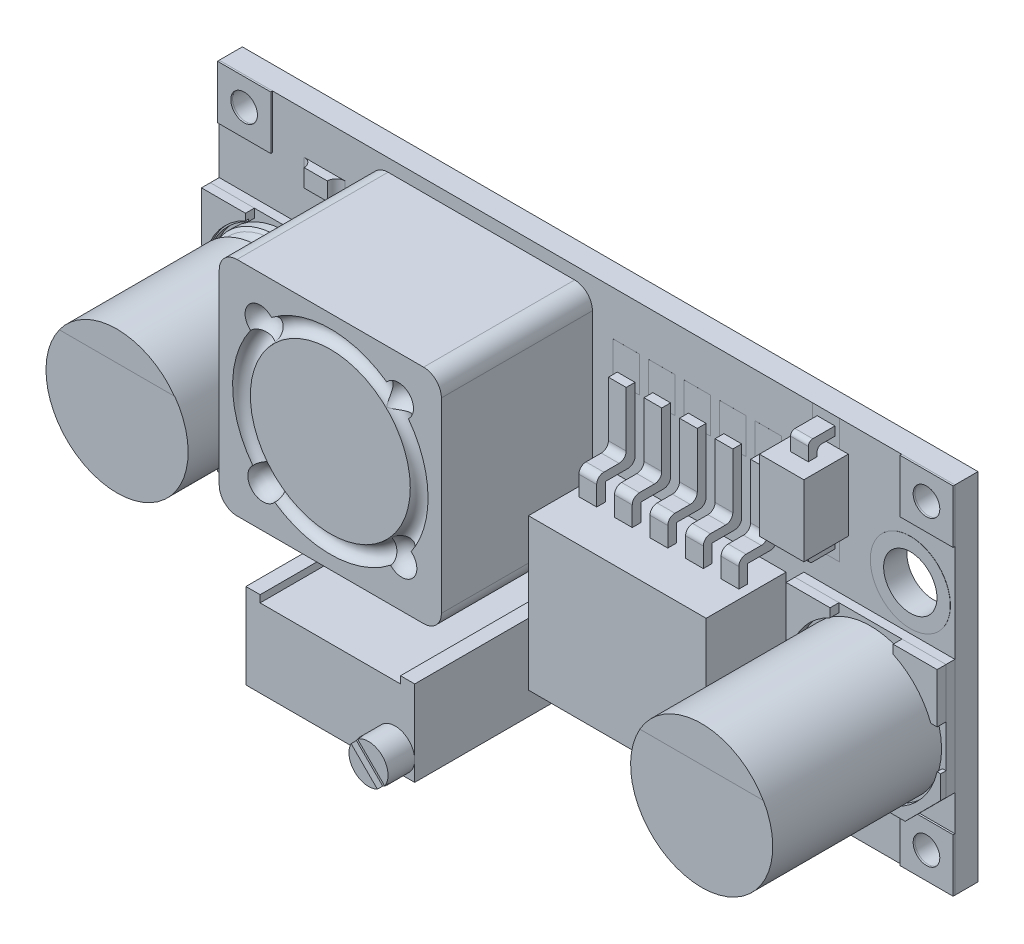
SolidWorks part; units mm, degrees
ref_plane "Ön Düzlem" through (0, 0, 0) normal (0, 0, 1) x (1, 0, 0)
ref_plane "Üst Düzlem" through (0, 0, 0) normal (0, 1, 0) x (1, 0, 0)
ref_plane "Sağ Düzlem" through (0, 0, 0) normal (1, 0, 0) x (0, 0, -1)
sketch "Çizim2" plane through (0, 0, 0) normal (0, 0, 1) x (1, 0, 0)
  line L1 (0, 0) -> (41.4, 0)
  line L2 (0, 0) -> (0, 20)
  line L3 (0, 20) -> (41.4, 20)
  line L4 (41.4, 0) -> (41.4, 20)
  dimension "D1" = 20
  dimension "D2" = 41.4
extrude "Yükseklik-Ekstrüzyon1" add sketch "Çizim2" along normal blind 1.3
sketch "Çizim3" plane through (0, 0, 1.3) normal (0, 0, 1) x (1, 0, 0)
  line L1 (0, 20) -> (3, 20)
  line L2 (0, 20) -> (0, 17)
  line L3 (0, 17) -> (3, 17)
  line L4 (3, 20) -> (3, 17)
  line L5 (0, 0) -> (3, 0)
  line L6 (0, 0) -> (0, 3)
  line L7 (0, 3) -> (3, 3)
  line L8 (3, 0) -> (3, 3)
  line L9 (41.4, 0) -> (38.4, 0)
  line L10 (41.4, 0) -> (41.4, 3)
  line L11 (41.4, 3) -> (38.4, 3)
  line L12 (38.4, 0) -> (38.4, 3)
  line L13 (41.4, 20) -> (38.4, 20)
  line L14 (41.4, 20) -> (41.4, 17)
  line L15 (41.4, 17) -> (38.4, 17)
  line L16 (38.4, 20) -> (38.4, 17)
  dimension "D1" = 3
  dimension "D2" = 3
  dimension "D3" = 3
  dimension "D4" = 3
  dimension "D5" = 3
  dimension "D6" = 3
  dimension "D7" = 3
  dimension "D8" = 3
extrude "Yükseklik-Ekstrüzyon3" add sketch "Çizim3" along normal blind 0.1 separate body
sketch "Çizim4" plane through (0, 0, 1.4) normal (0, 0, 1) x (1, 0, 0)
  line L0 (38.4, 3) -> (38.4, 0) construction
  line L1 (41.4, 3) -> (38.4, 3) construction
  line L2 (0, 10) -> (50.265, 10) construction
  line L3 (0, 20) -> (0, 0) construction
  line L4 (20.7, 20) -> (20.7, 0) construction
  line L5 (41.4, 20) -> (0, 20) construction
  line L6 (0, 0) -> (41.4, 0) construction
  circle A0 centre (39.9, 1.5) radius 0.75
  circle A1 centre (39.9, 18.5) radius 0.75
  circle A2 centre (1.5, 18.5) radius 0.75
  circle A3 centre (1.5, 1.5) radius 0.75
  dimension "D1" = 1.5
  dimension "D2" = 1.5
  dimension "D3" = 1.5
extrude "Kes-Ekstrüzyon1" cut sketch "Çizim4" against normal through all
sketch "Çizim5" plane through (0, 0, 1.3) normal (0, 0, 1) x (1, 0, 0)
  line L0 (11.5, 0.3) -> (21, 0.3)
  line L1 (21, 0.3) -> (21, 5.1)
  line L2 (21, 5.1) -> (20.2, 5.1)
  line L3 (20.2, 5.1) -> (20.2, 4.7)
  line L4 (20.2, 4.7) -> (12.3, 4.7)
  line L5 (12.3, 4.7) -> (12.3, 5.1)
  line L6 (12.3, 5.1) -> (11.5, 5.1)
  line L7 (11.5, 5.1) -> (11.5, 0.3)
  line L8 (0, 20) -> (0, 0) construction
  line L9 (0, 0) -> (41.4, 0) construction
  dimension "D1" = 11.5
  dimension "D2" = 9.5
  dimension "D3" = 0.8
  dimension "D4" = 0.8
  dimension "D5" = 0.3
  dimension "D6" = 4.8
  dimension "D7" = 4.4
  dimension "D8" = 4.8
extrude "Yükseklik-Ekstrüzyon4" add sketch "Çizim5" along normal blind 10
sketch "Çizim6" plane through (0, 0, 11.3) normal (0, 0, 1) x (1, 0, 0)
  line L0 (21, 0.3) -> (21, 5.1) construction
  line L1 (11.5, 0.3) -> (21, 0.3) construction
  circle A0 centre (19.9, 1.4) radius 1.1
  dimension "D1" = 2.2
extrude "Yükseklik-Ekstrüzyon5" add sketch "Çizim6" along normal blind 1.5
sketch "Çizim7" plane through (0, 0, 12.8) normal (0, 0, 1) x (1, 0, 0)
  line L0 (18.7701, 2.0519) -> (19.1564, 2.4382)
  line L1 (19.1564, 2.4382) -> (21, 0.5946)
  line L2 (21, 0.3) -> (21, 1.4) construction
  line L3 (21, 0.5946) -> (20.6137, 0.2083)
  line L4 (20.6137, 0.2083) -> (18.7701, 2.0519)
  line L5 (18.7701, 2.0519) -> (18.7867, 2.0602)
extrude "Kes-Ekstrüzyon2" cut sketch "Çizim7" against normal blind 0.3 contours L4 L1 M5
sketch "Çizim8" plane through (0, 0, 1.3) normal (0, 0, 1) x (1, 0, 0)
  line L0 (0, 20) -> (0, 0) construction
  line L1 (0, 0) -> (41.4, 0) construction
  circle A0 centre (6, 2.5) radius 1.5
  dimension "D1" = 3
  dimension "D2" = 6
  dimension "D3" = 2.5
extrude "Kes-Ekstrüzyon3" cut sketch "Çizim8" against normal blind 10
sketch "Çizim9" plane through (0, 0, 1.3) normal (0, 0, 1) x (1, 0, 0)
  circle A0 centre (6, 2.5) radius 2.25
  circle A1 centre (6, 2.5) radius 1.5
  dimension "D1" = 4.5
extrude "Yükseklik-Ekstrüzyon7" add sketch "Çizim9" along normal blind 0.05
sketch "Çizim10" plane through (0, 0, 1.3) normal (0, 0, 1) x (1, 0, 0)
  line L1 (9.3325, 4.1337) -> (10.3325, 4.1337)
  line L2 (9.3325, 4.1337) -> (9.3325, 1.1337)
  line L3 (9.3325, 1.1337) -> (10.3325, 1.1337)
  line L4 (10.3325, 4.1337) -> (10.3325, 1.1337)
  dimension "D1" = 3
  dimension "D2" = 1
extrude "Yükseklik-Ekstrüzyon8" add sketch "Çizim10" along normal blind 0.5
sketch "Çizim11" plane through (9.3325, 0, 0) normal (-1, 0, 0) x (0, 0, 1)
  line L0 (1.3, 3.6337) -> (1.3, 4.1337)
  line L1 (1.3, 4.1337) -> (1.3, 1.1337) construction
  line L2 (1.8, 4.1337) -> (1.8, 1.1337) construction
  line L3 (1.3, 3.6337) -> (1.8, 3.6337)
  line L4 (1.8, 3.6337) -> (1.8, 4.1337)
  line L5 (1.8, 4.1337) -> (1.3, 4.1337)
  line L6 (1.3, 4.1337) -> (1.8, 4.1337)
  line L7 (1.8, 2.6337) -> (1.3, 2.6337) construction
  line L8 (1.3, 1.1337) -> (1.8, 1.1337)
  line L9 (1.8, 1.1337) -> (1.3, 1.1337)
  line L10 (1.8, 1.6337) -> (1.8, 1.1337)
  line L11 (1.3, 1.6337) -> (1.8, 1.6337)
  line L12 (1.3, 1.6337) -> (1.3, 1.1337)
  arc A0 (1.8, 3.6337) -> (1.3, 4.1337) centre (1.8, 4.1337) cw
  arc A1 (1.8, 1.6337) -> (1.3, 1.1337) centre (1.8, 1.1337) ccw
  point P0 (1.3, 3.6337)
  point P1 (1.8, 3.6337)
  point P4 (1.3, 4.1337)
  dimension "D1" = 0.5
extrude "Kes-Ekstrüzyon5" cut sketch "Çizim11" against normal blind 1 contours A0 M3 M4 | A1 M3 M2
sketch "Çizim12" plane through (0, 0, 1.3) normal (0, 0, 1) x (1, 0, 0)
  line L0 (21, 1.4) -> (21, 5.1) construction
  line L1 (8.5, 19.2887) -> (21, 19.2887)
  line L2 (8.5, 19.2887) -> (8.5, 6.7887)
  line L3 (8.5, 6.7887) -> (21, 6.7887)
  line L4 (21, 19.2887) -> (21, 6.7887)
  dimension "D1" = 12.5
  dimension "D2" = 12.5
extrude "Yükseklik-Ekstrüzyon9" add sketch "Çizim12" along normal blind 8.5
fillet "Radyus1" radius 1 4 edges at (8.5, 6.7887, 5.55) (21, 6.7887, 5.55) (21, 19.2887, 5.55) (8.5, 19.2887, 5.55)
ref_plane "Düzlem1" through (0, 13.0387, 0) normal (0, 1, 0) x (1, 0, 0)
sketch "Çizim14" plane through (0, 13.0387, 0) normal (0, 1, 0) x (1, 0, 0)
  line L0 (14.751, -9.8) -> (14.751, -0.4619) construction
  line L1 (10.251, -9.8) -> (9.251, -9.8)
  line L2 (20, -9.8) -> (9.5, -9.8) construction
  arc A0 (10.251, -9.8) -> (9.251, -9.8) centre (9.751, -9.8) ccw
  dimension "D1" = 1
  dimension "D2" = 5
revolve "Kes-Döndür1" cut sketch "Çizim14" angle 360 about L0
sketch "Çizim15" plane through (0, 0, 9.8) normal (0, 0, 1) x (1, 0, 0)
  line L0 (17.9163, 17.5156) -> (19.1436, 16.3486) construction
  line L1 (17.9163, 17.5156) -> (19.1436, 16.3486)
  arc A0 (19.1436, 16.3486) -> (17.9163, 17.5156) centre (18.5811, 16.9859) ccw
  circle A1 centre (14.751, 13.0387) radius 5.5 construction
  dimension "D2" = 1.7
revolve "Kes-Döndür2" cut sketch "Çizim15" angle 360 about L0
sketch "Çizim16" plane through (0, 0, 9.8) normal (0, 0, 1) x (1, 0, 0)
  line L0 (18.1439, 8.71) -> (19.3009, 9.9486)
  arc A0 (18.1439, 8.71) -> (19.3009, 9.9486) centre (18.7704, 9.2845) ccw
  arc A1 (17.9272, 17.5289) -> (19.1436, 16.3486) centre (14.751, 13.0387) ccw construction
  dimension "D1" = 1.7
revolve "Kes-Döndür3" cut sketch "Çizim16" angle 360 about L0
sketch "Çizim17" plane through (0, 0, 9.8) normal (0, 0, 1) x (1, 0, 0)
  line L0 (10.2607, 16.2147) -> (11.4409, 17.4312)
  arc A0 (11.4409, 17.4312) -> (10.2607, 16.2147) centre (10.8037, 16.8687) ccw
  arc A1 (17.9272, 17.5289) -> (18.1439, 8.71) centre (14.751, 13.0387) ccw construction
  dimension "D1" = 1.7
revolve "Kes-Döndür4" cut sketch "Çizim17" angle 360 about L0
sketch "Çizim18" plane through (0, 0, 9.8) normal (0, 0, 1) x (1, 0, 0)
  line L0 (11.6178, 8.5185) -> (10.3902, 9.6871)
  arc A0 (10.3902, 9.6871) -> (11.6178, 8.5185) centre (10.9587, 9.0552) ccw
  arc A1 (10.2607, 16.2147) -> (18.1439, 8.71) centre (14.751, 13.0387) ccw construction
  dimension "D1" = 1.7
revolve "Kes-Döndür5" cut sketch "Çizim18" angle 360 about L0
sketch "Çizim19" plane through (0, 0, 1.3) normal (0, 0, 1) x (1, 0, 0)
  line L0 (0, 20) -> (0, 0) construction
  line L1 (0, 14.2784) -> (8.5, 14.2784)
  line L2 (0, 14.2784) -> (0, 7.7784)
  line L3 (2, 5.7784) -> (6.5, 5.7784)
  line L4 (8.5, 14.2784) -> (8.5, 7.7784)
  line L5 (0, 7.7784) -> (2, 5.7784)
  line L6 (8.5, 7.7784) -> (6.5, 5.7784)
  point P1 (8.5, 5.7784)
  point P2 (0, 5.7784)
  point P8 (0, 10)
  point P9 (0, 10.0284)
  dimension "D1" = 8.5
  dimension "D2" = 8.5
  dimension "D3" = 2
  dimension "D4" = 45
  dimension "D5" = 2
  dimension "D6" = 45
extrude "Yükseklik-Ekstrüzyon13" add sketch "Çizim19" along normal blind 0.5 separate body
sketch "Çizim20" plane through (0, 0, 1.8) normal (0, 0, 1) x (1, 0, 0)
  line L0 (8.5, 14.2784) -> (0, 14.2784) construction
  line L1 (0, 14.2784) -> (0, 7.7784) construction
  line L2 (8.2976, 9.0941) -> (8.5, 9.0941)
  line L3 (8.5, 7.7784) -> (8.5, 14.2784) construction
  line L4 (8.5, 9.0941) -> (8.5, 7.7887)
  line L5 (8.5, 7.7887) -> (6.5, 5.7784)
  line L6 (6.5, 5.7784) -> (5.0293, 5.7784)
  line L7 (2, 5.7784) -> (6.5, 5.7784) construction
  line L8 (5.0293, 5.7784) -> (5.0293, 5.9481)
  line L9 (3.4559, 5.7784) -> (3.4559, 5.951)
  line L10 (3.4559, 5.7784) -> (2, 5.7784)
  line L11 (2, 5.7784) -> (0, 7.7784)
  line L12 (0, 7.7784) -> (0, 9.554)
  line L13 (0, 9.554) -> (0.1231, 9.554)
  line L14 (0.3573, 11.4787) -> (0, 11.4787)
  line L15 (0, 11.4787) -> (0, 14.2784)
  line L16 (0, 14.2784) -> (2.4756, 14.2784)
  line L17 (2.4756, 14.2784) -> (2.4756, 13.7844)
  line L18 (4.25, 14.2784) -> (4.25, 14.0284) construction
  line L19 (6.0244, 14.2784) -> (6.0244, 13.7844)
  line L20 (8.5, 14.2784) -> (6.0244, 14.2784)
  line L21 (8.5, 11.4787) -> (8.5, 14.2784)
  line L22 (8.1427, 11.4787) -> (8.5, 11.4787)
  circle A0 centre (4.25, 10.0284) radius 4
  arc A1 (5.0293, 5.9481) -> (8.2976, 9.0941) centre (4.25, 10.0284) ccw
  arc A2 (0.1231, 9.554) -> (3.4559, 5.951) centre (4.25, 10.0284) ccw
  arc A3 (2.4756, 13.7844) -> (0.3573, 11.4787) centre (4.25, 10.0284) ccw
  arc A4 (8.1427, 11.4787) -> (6.0244, 13.7844) centre (4.25, 10.0284) ccw
  dimension "D1" = 8
  dimension "D2" = 4.25
  dimension "D3" = 4.25
extrude "Yükseklik-Ekstrüzyon14" add sketch "Çizim20" along normal blind 0.3 separate body
sketch "Çizim21" plane through (0, 0, 2.1) normal (0, 0, 1) x (1, 0, 0)
  line L0 (0, 11.4787) -> (0, 14.2784)
  line L1 (0, 14.2784) -> (2.4756, 14.2784)
  line L2 (2.4756, 14.2784) -> (2.4756, 13.7844)
  line L3 (0, 11.4787) -> (0.3573, 11.4787)
  line L4 (4.25, 14.3771) -> (4.25, 9.7763) construction
  line L5 (8.5, 11.4787) -> (8.1427, 11.4787)
  line L6 (6.0244, 14.2784) -> (6.0244, 13.7844)
  line L7 (8.5, 14.2784) -> (6.0244, 14.2784)
  line L8 (8.5, 11.4787) -> (8.5, 14.2784)
  arc A0 (2.4756, 13.7844) -> (1.1909, 12.8388) centre (4.25, 10.0284) ccw
  arc A1 (2.4756, 13.7844) -> (0.3573, 11.4787) centre (4.25, 10.0284) ccw construction
  arc A2 (0.3573, 11.4787) -> (1.1909, 12.8388) centre (4.25, 10.0284) cw
  arc A3 (8.1427, 11.4787) -> (7.3091, 12.8388) centre (4.25, 10.0284) ccw
  arc A4 (6.0244, 13.7844) -> (7.3091, 12.8388) centre (4.25, 10.0284) cw
extrude "Yükseklik-Ekstrüzyon15" add sketch "Çizim21" along normal blind 0.2
sketch "Çizim22" plane through (0, 0, 2.1) normal (0, 0, 1) x (1, 0, 0)
  circle A0 centre (4.25, 10.0284) radius 4
extrude "Yükseklik-Ekstrüzyon16" add sketch "Çizim22" along normal blind 0.5
sketch "Çizim23" plane through (0, 0, 2.6) normal (0, 0, 1) x (1, 0, 0)
  circle A0 centre (4.25, 10.0284) radius 4
extrude "Yükseklik-Ekstrüzyon17" add sketch "Çizim23" along normal blind 8.7
ref_plane "Düzlem2" through (0, 10.1684, 0) normal (0, -1, 0) x (-1, 0, 0)
sketch "Çizim24" plane through (0, 10.1684, 0) normal (0, -1, 0) x (-1, 0, 0)
  line L0 (-4.25, -13.046) -> (-4.25, -1.3099) construction
  line L1 (-8.25, -11.3) -> (-0.25, -11.3) construction
  line L2 (-2, -1.8) -> (-6.5, -1.8) construction
  line L3 (-0.25, -11.3) -> (-0.25, -1.8) construction
  line L4 (-0.25, -2.3) -> (-0.25, -2.1319)
  line L5 (-0.25, -2.1319) -> (-0.5413, -2.3936)
  line L6 (-0.2499, -3.3645) -> (-0.25, -2.1319)
  line L7 (-0.25, -2.1319) -> (-0.108, -2.1319)
  line L8 (-0.108, -2.1319) -> (-0.108, -3.3645)
  line L9 (-0.108, -3.3645) -> (-0.2499, -3.3645)
  arc A0 (-0.25, -2.3) -> (-0.3102, -3.2964) centre (-0.25, -2.8) ccw
  arc A1 (-0.2499, -3.3645) -> (-0.3102, -3.2964) centre (-0.3185, -3.3645) ccw
  point P7 (-0.2499, -3.3645)
  point P8 (-4.25, -1.8)
  dimension "D3" = 1
  dimension "D1" = 0
  dimension "D2" = 11.7362
  dimension "D4" = 0
  dimension "D5" = 1
revolve "Kes-Döndür10" cut sketch "Çizim24" angle 360 about L0
sketch "Çizim25" plane through (0, 0, 11.3) normal (0, 0, 1) x (1, 0, 0)
  line L0 (1.0082, 12.3716) -> (7.4918, 12.3716)
  circle A0 centre (4.25, 10.0284) radius 4 construction
  arc A1 (7.4918, 12.3716) -> (1.0082, 12.3716) centre (4.25, 10.0284) ccw
extrude "Yükseklik-Ekstrüzyon18" add sketch "Çizim25" along normal blind 0.01
sketch "Çizim26" plane through (0, 0, 1.3) normal (0, 0, 1) x (1, 0, 0)
  line L1 (4.779, 17.6556) -> (7.079, 17.6556)
  line L2 (4.779, 17.6556) -> (4.779, 16.6556)
  line L3 (4.779, 16.6556) -> (7.079, 16.6556)
  line L4 (7.079, 17.6556) -> (7.079, 16.6556)
  dimension "D1" = 2.3
  dimension "D2" = 1
extrude "Yükseklik-Ekstrüzyon20" add sketch "Çizim26" along normal blind 0.5 separate body
sketch "Çizim29" plane through (0, 17.6556, 0) normal (0, 1, 0) x (1, 0, 0)
  line L1 (7.079, -1.8) -> (6.579, -1.8)
  line L2 (7.079, -1.8) -> (7.079, -1.3)
  line L6 (4.779, -1.8) -> (5.279, -1.8)
  line L7 (4.779, -1.8) -> (4.779, -1.3)
  arc A0 (6.579, -1.8) -> (7.079, -1.3) centre (7.079, -1.8) cw
  arc A1 (5.279, -1.8) -> (4.779, -1.3) centre (4.779, -1.8) ccw
extrude "Kes-Ekstrüzyon13" cut sketch "Çizim29" against normal blind 1
sketch "Çizim30" plane through (0, 0, 1.3) normal (0, 0, 1) x (1, 0, 0)
  line L0 (32.9, 11.5) -> (41.4, 11.5)
  line L1 (32.9, 11.5) -> (32.9, 5)
  line L2 (34.9, 3) -> (39.4, 3)
  line L3 (41.4, 11.5) -> (41.4, 5)
  line L4 (32.9, 5) -> (34.9, 3)
  line L5 (41.4, 5) -> (39.4, 3)
  line L8 (41.4, 0) -> (41.4, 20) construction
  line L9 (41.4, 3) -> (38.4, 3) construction
  point P1 (41.4, 3)
  point P2 (32.9, 3)
  point P6 (31.6305, 8.2841)
  point P7 (31.6305, 8.3125)
  dimension "D1" = 8.5
  dimension "D2" = 2
  dimension "D3" = 45
  dimension "D4" = 2
  dimension "D5" = 45
  dimension "D6" = 8.5
extrude "Yükseklik-Ekstrüzyon21" add sketch "Çizim30" along normal blind 0.5 separate body
sketch "Çizim32" plane through (0, 0, 1.8) normal (0, 0, 1) x (1, 0, 0)
  line L0 (41.1976, 6.3196) -> (41.4, 6.3196)
  line L1 (41.4, 6.3196) -> (41.4, 5.0142)
  line L2 (41.4, 5.0142) -> (39.4, 3.0039)
  line L3 (39.4, 3.0039) -> (37.9293, 3.0039)
  line L4 (37.9293, 3.0039) -> (37.9293, 3.1736)
  line L5 (36.3559, 3) -> (36.3559, 3.1765)
  line L6 (36.3559, 3) -> (34.9, 3)
  line L7 (34.9, 3) -> (32.9, 5)
  line L8 (32.9, 5) -> (32.9, 6.7795)
  line L9 (32.9, 6.7795) -> (33.0231, 6.7795)
  line L10 (33.2573, 8.7042) -> (32.9, 8.7042)
  line L11 (32.9, 8.7042) -> (32.9, 11.5)
  line L12 (32.9, 11.5) -> (35.3756, 11.5)
  line L13 (35.3756, 11.5) -> (35.3756, 11.0099)
  line L14 (37.15, 11.5039) -> (37.15, 11.2539) construction
  line L15 (38.9244, 11.5) -> (38.9244, 11.0099)
  line L16 (41.4, 11.5) -> (38.9244, 11.5)
  line L17 (41.4, 8.7042) -> (41.4, 11.5)
  line L18 (41.0427, 8.7042) -> (41.4, 8.7042)
  line L19 (34.9, 3) -> (39.4, 3) construction
  line L20 (32.9, 5) -> (34.9, 3) construction
  line L21 (32.9, 11.5) -> (32.9, 5) construction
  line L22 (41.4, 11.5) -> (32.9, 11.5) construction
  line L23 (41.4, 5) -> (41.4, 11.5) construction
  circle A0 centre (37.15, 7.2539) radius 4
  arc A1 (37.9293, 3.1736) -> (41.1976, 6.3196) centre (37.15, 7.2539) ccw
  arc A2 (33.0231, 6.7795) -> (36.3559, 3.1765) centre (37.15, 7.2539) ccw
  arc A3 (35.3756, 11.0099) -> (33.2573, 8.7042) centre (37.15, 7.2539) ccw
  arc A4 (41.0427, 8.7042) -> (38.9244, 11.0099) centre (37.15, 7.2539) ccw
  dimension "D1" = 8
extrude "Yükseklik-Ekstrüzyon22" add sketch "Çizim32" along normal blind 0.3 separate body
sketch "Çizim33" plane through (0, 0, 2.1) normal (0, 0, 1) x (1, 0, 0)
  line L0 (32.9, 11.5) -> (35.3756, 11.5)
  line L2 (35.3756, 11.5) -> (35.3756, 11.0099)
  line L3 (33.2573, 8.7042) -> (32.9, 8.7042)
  line L4 (32.9, 8.7042) -> (32.9, 11.5)
  line L6 (38.9244, 11.5) -> (41.4, 11.5)
  line L7 (41.4, 11.5) -> (41.4, 8.7042)
  line L8 (41.4, 8.7042) -> (41.0427, 8.7042)
  line L9 (38.9244, 11.0099) -> (38.9244, 11.5)
  arc A0 (33.2573, 8.7042) -> (35.3756, 11.0099) centre (37.15, 7.2539) cw
  arc A1 (41.0427, 8.7042) -> (38.9244, 11.0099) centre (37.15, 7.2539) ccw
extrude "Yükseklik-Ekstrüzyon24" add sketch "Çizim33" along normal blind 0.2
sketch "Çizim34" plane through (0, 0, 2.1) normal (0, 0, 1) x (1, 0, 0)
  circle A0 centre (37.15, 7.2539) radius 4
extrude "Yükseklik-Ekstrüzyon25" add sketch "Çizim34" along normal blind 0.5
sketch "Çizim35" plane through (0, 0, 2.6) normal (0, 0, 1) x (1, 0, 0)
  circle A0 centre (37.15, 7.2539) radius 4
extrude "Yükseklik-Ekstrüzyon26" add sketch "Çizim35" along normal blind 8.7
sketch "Çizim41" plane through (0, 0, 11.3) normal (0, 0, 1) x (1, 0, 0)
  line L0 (33.6784, 9.2409) -> (40.6216, 9.2409)
  circle A0 centre (37.15, 7.2539) radius 4 construction
  arc A1 (33.6784, 9.2409) -> (40.6216, 9.2409) centre (37.15, 7.2539) cw
extrude "Yükseklik-Ekstrüzyon27" add sketch "Çizim41" along normal blind 0.01
sketch "Çizim44" plane through (0, 0, 1.3) normal (0, 0, 1) x (1, 0, 0)
  line L0 (41.4, 0) -> (41.4, 20) construction
  line L1 (41.4, 20) -> (0, 20) construction
  circle A0 centre (38.9, 14) radius 1.5
  point P6 (38.7771, 15.0052)
  dimension "D1" = 3
  dimension "D2" = 2.5
  dimension "D3" = 6
extrude "Kes-Ekstrüzyon14" cut sketch "Çizim44" against normal through all
sketch "Çizim45" plane through (0, 0, 1.3) normal (0, 0, 1) x (1, 0, 0)
  circle A0 centre (38.9, 14) radius 2.25
  circle A1 centre (38.9, 14) radius 1.5
  dimension "D1" = 4.5
extrude "Yükseklik-Ekstrüzyon28" add sketch "Çizim45" along normal blind 0.01
sketch "Çizim46" plane through (0, 0, 1.3) normal (0, 0, 1) x (1, 0, 0)
  line L0 (41.4, 20) -> (0, 20) construction
  line L1 (32.9, 18.5) -> (35.4, 18.5)
  line L2 (32.9, 18.5) -> (32.9, 14.5)
  line L3 (32.9, 14.5) -> (35.4, 14.5)
  line L4 (35.4, 18.5) -> (35.4, 14.5)
  line L5 (32.9, 11.5) -> (32.9, 8.7042) construction
  dimension "D1" = 2.5
  dimension "D2" = 4
  dimension "D3" = 1.5
extrude "Yükseklik-Ekstrüzyon29" add sketch "Çizim46" along normal blind 2.5 separate body
sketch "Çizim48" plane through (0, 14.5, 0) normal (0, -1, 0) x (1, 0, 0)
  line L0 (32.9, 3.8) -> (35.4, 3.8) construction
  line L1 (33.65, 2.8) -> (34.65, 2.8)
  line L2 (33.65, 2.8) -> (33.65, 2.3)
  line L3 (33.65, 2.3) -> (34.65, 2.3)
  line L4 (34.65, 2.8) -> (34.65, 2.3)
  line L5 (35.4, 3.8) -> (35.4, 1.3) construction
  dimension "D1" = 1
  dimension "D2" = 0.5
  dimension "D3" = 1
  dimension "D4" = 0.75
extrude "Yükseklik-Ekstrüzyon30" add sketch "Çizim48" along normal blind 0.5 separate body
sketch "Çizim49" plane through (0, 18.5, 0) normal (0, 1, 0) x (1, 0, 0)
  line L0 (35.4, -3.8) -> (32.9, -3.8) construction
  line L1 (34.65, -2.8) -> (33.65, -2.8)
  line L2 (34.65, -2.8) -> (34.65, -2.3)
  line L3 (34.65, -2.3) -> (33.65, -2.3)
  line L4 (33.65, -2.8) -> (33.65, -2.3)
  line L5 (32.9, -3.8) -> (32.9, -1.3) construction
  dimension "D1" = 1
  dimension "D2" = 0.5
  dimension "D3" = 1
  dimension "D4" = 0.75
extrude "Yükseklik-Ekstrüzyon31" add sketch "Çizim49" along normal blind 0.5 separate body
sketch "Çizim50" plane through (0, 0, 2.8) normal (0, 0, 1) x (1, 0, 0)
  line L1 (33.65, 19) -> (34.65, 19)
  line L2 (33.65, 19) -> (33.65, 19.5)
  line L3 (33.65, 19.5) -> (34.65, 19.5)
  line L4 (34.65, 19) -> (34.65, 19.5)
  line L5 (34.65, 14) -> (33.65, 14)
  line L6 (34.65, 14) -> (34.65, 13.5)
  line L7 (34.65, 13.5) -> (33.65, 13.5)
  line L8 (33.65, 14) -> (33.65, 13.5)
  dimension "D1" = 0.5
  dimension "D2" = 0.5
  dimension "D3" = 1
  dimension "D4" = 1
extrude "Yükseklik-Ekstrüzyon32" add sketch "Çizim50" against normal blind 1.5
fillet "Radyus2" radius 0.25 4 edges at (34.15, 14, 2.3) (34.15, 13.5, 2.8) (34.15, 19, 2.3) (34.15, 19.5, 2.8)
sketch "Çizim51" plane through (0, 0, 1.3) normal (0, 0, 1) x (1, 0, 0)
  line L0 (0, 0) -> (41.4, 0) construction
  line L1 (21.9, 11) -> (31.9, 11)
  line L2 (21.9, 11) -> (21.9, 2.5)
  line L3 (21.9, 2.5) -> (31.9, 2.5)
  line L4 (31.9, 11) -> (31.9, 2.5)
  line L5 (32.9, 11.5) -> (32.9, 8.7042) construction
  dimension "D1" = 8.5
  dimension "D2" = 2.5
  dimension "D3" = 10
  dimension "D4" = 1
extrude "Yükseklik-Ekstrüzyon33" add sketch "Çizim51" along normal blind 4.5 separate body
sketch "Çizim54" plane through (0, 0, 1.3) normal (0, 0, 1) x (1, 0, 0)
  line L0 (31.9, 1.25) -> (30.9, 1)
  line L1 (21.9, 2.5) -> (31.9, 2.5)
  line L2 (21.9, 2.5) -> (21.9, 1.25)
  line L3 (22.9, 1) -> (30.9, 1)
  line L4 (31.9, 2.5) -> (31.9, 1.25)
  line L5 (21.9, 1.25) -> (22.9, 1)
  point P1 (31.9, 1)
  point P2 (21.9, 1)
  dimension "D1" = 1.5
  dimension "D2" = 0.25
  dimension "D3" = 1
  dimension "D4" = 0.25
  dimension "D5" = 1
extrude "Yükseklik-Ekstrüzyon34" add sketch "Çizim54" along normal blind 1 separate body
sketch "Çizim55" plane through (0, 11, 0) normal (0, 1, 0) x (1, 0, 0)
  line L0 (21.9, -5.8) -> (21.9, -1.3) construction
  line L1 (30.4, -2.9578) -> (31.4, -2.9578)
  line L2 (30.4, -2.9578) -> (30.4, -3.4578)
  line L3 (30.4, -3.4578) -> (31.4, -3.4578)
  line L4 (31.4, -2.9578) -> (31.4, -3.4578)
  line L5 (28.4, -2.9578) -> (29.4, -2.9578)
  line L6 (28.4, -2.9578) -> (28.4, -3.4578)
  line L7 (28.4, -3.4578) -> (29.4, -3.4578)
  line L8 (29.4, -2.9578) -> (29.4, -3.4578)
  line L9 (26.4, -2.9578) -> (27.4, -2.9578)
  line L10 (26.4, -2.9578) -> (26.4, -3.4578)
  line L11 (26.4, -3.4578) -> (27.4, -3.4578)
  line L12 (27.4, -2.9578) -> (27.4, -3.4578)
  line L13 (24.4, -2.9578) -> (25.4, -2.9578)
  line L14 (24.4, -2.9578) -> (24.4, -3.4578)
  line L15 (24.4, -3.4578) -> (25.4, -3.4578)
  line L16 (25.4, -2.9578) -> (25.4, -3.4578)
  line L17 (22.4, -2.9578) -> (23.4, -2.9578)
  line L18 (22.4, -2.9578) -> (22.4, -3.4578)
  line L19 (22.4, -3.4578) -> (23.4, -3.4578)
  line L20 (23.4, -2.9578) -> (23.4, -3.4578)
  line L21 (31.9, -5.8) -> (31.9, -1.3) construction
  dimension "D1" = 1
  dimension "D2" = 0.5
  dimension "D3" = 1
  dimension "D4" = 0.5
  dimension "D5" = 1
  dimension "D6" = 0.5
  dimension "D7" = 1
  dimension "D8" = 0.5
  dimension "D9" = 1
  dimension "D10" = 0.5
  dimension "D11" = 0.5
  dimension "D12" = 0.5
  dimension "D13" = 1
  dimension "D14" = 1
  dimension "D15" = 1
extrude "Yükseklik-Ekstrüzyon35" add sketch "Çizim55" along normal blind 1 separate body
sketch "Çizim59" plane through (31.4, 0, 0) normal (1, 0, 0) x (0, 0, -1)
  line L0 (-2.9578, 12) -> (-1.6978, 12)
  line L1 (-1.2978, 12.4) -> (-1.2978, 16)
  line L2 (-3.4578, 12) -> (-3.4578, 12.1)
  line L3 (-3.0578, 12.5) -> (-2.1978, 12.5)
  line L4 (-1.7978, 12.9) -> (-1.7978, 16)
  line L5 (-1.7978, 16) -> (-1.2978, 16)
  line L6 (-2.9578, 12) -> (-3.4578, 12)
  arc A0 (-1.6978, 12) -> (-1.2978, 12.4) centre (-1.6978, 12.4) ccw
  arc A1 (-2.1978, 12.5) -> (-1.7978, 12.9) centre (-2.1978, 12.9) ccw
  arc A2 (-3.4578, 12.1) -> (-3.0578, 12.5) centre (-3.0578, 12.1) cw
  point P11 (-1.2978, 12)
  point P14 (-1.7978, 12.5)
  point P17 (-3.4578, 12.5)
  dimension "D5" = 0.4
  dimension "D1" = 1.66
  dimension "D2" = 4
  dimension "D3" = 1.66
  dimension "D4" = 0.5
extrude "Yükseklik-Ekstrüzyon38" add sketch "Çizim59" against normal blind 1
sketch "Çizim60" plane through (29.4, 0, 0) normal (1, 0, 0) x (0, 0, -1)
  line L0 (-2.9578, 12) -> (-1.6978, 12)
  line L1 (-1.2978, 12.4) -> (-1.2978, 16)
  line L2 (-3.4578, 12) -> (-3.4578, 12.1)
  line L3 (-3.0578, 12.5) -> (-2.1978, 12.5)
  line L4 (-1.7978, 12.9) -> (-1.7978, 16)
  line L5 (-1.7978, 16) -> (-1.2978, 16)
  line L6 (-2.9578, 12) -> (-3.4578, 12)
  arc A0 (-1.6978, 12) -> (-1.2978, 12.4) centre (-1.6978, 12.4) ccw
  arc A1 (-2.1978, 12.5) -> (-1.7978, 12.9) centre (-2.1978, 12.9) ccw
  arc A2 (-3.4578, 12.1) -> (-3.0578, 12.5) centre (-3.0578, 12.1) cw
  dimension "D1" = 0.4
  dimension "D5" = 1.26
  dimension "D2" = 3.1
  dimension "D3" = 3.6
  dimension "D4" = 0.5
extrude "Yükseklik-Ekstrüzyon39" add sketch "Çizim60" against normal blind 1
sketch "Çizim61" plane through (27.4, 0, 0) normal (1, 0, 0) x (0, 0, -1)
  line L0 (-2.9578, 12) -> (-1.6978, 12)
  line L1 (-1.2978, 12.4) -> (-1.2978, 16)
  line L2 (-3.4578, 12) -> (-3.4578, 12.1)
  line L3 (-3.0578, 12.5) -> (-2.1978, 12.5)
  line L4 (-1.7978, 12.9) -> (-1.7978, 16)
  line L5 (-1.7978, 16) -> (-1.2978, 16)
  line L6 (-2.9578, 12) -> (-3.4578, 12)
  arc A0 (-1.6978, 12) -> (-1.2978, 12.4) centre (-1.6978, 12.4) ccw
  arc A1 (-2.1978, 12.5) -> (-1.7978, 12.9) centre (-2.1978, 12.9) ccw
  arc A2 (-3.4578, 12.1) -> (-3.0578, 12.5) centre (-3.0578, 12.1) cw
  dimension "D1" = 0.4
extrude "Yükseklik-Ekstrüzyon40" add sketch "Çizim61" against normal blind 1
sketch "Çizim62" plane through (25.4, 0, 0) normal (1, 0, 0) x (0, 0, -1)
  line L0 (-2.9578, 12) -> (-1.6978, 12)
  line L1 (-1.2978, 12.4) -> (-1.2978, 16)
  line L2 (-3.4578, 12) -> (-3.4578, 12.1)
  line L3 (-3.0578, 12.5) -> (-2.1978, 12.5)
  line L4 (-1.7978, 12.9) -> (-1.7978, 16)
  line L5 (-1.7978, 16) -> (-1.2978, 16)
  line L6 (-2.9578, 12) -> (-3.4578, 12)
  arc A0 (-1.6978, 12) -> (-1.2978, 12.4) centre (-1.6978, 12.4) ccw
  arc A1 (-2.1978, 12.5) -> (-1.7978, 12.9) centre (-2.1978, 12.9) ccw
  arc A2 (-3.4578, 12.1) -> (-3.0578, 12.5) centre (-3.0578, 12.1) cw
  dimension "D1" = 0.4
extrude "Yükseklik-Ekstrüzyon41" add sketch "Çizim62" against normal blind 1
sketch "Çizim63" plane through (23.4, 0, 0) normal (1, 0, 0) x (0, 0, -1)
  line L0 (-2.9578, 12) -> (-1.6978, 12)
  line L1 (-1.2978, 12.4) -> (-1.2978, 16)
  line L2 (-3.4578, 12) -> (-3.4578, 12.1)
  line L3 (-3.0578, 12.5) -> (-2.1978, 12.5)
  line L4 (-1.7978, 12.9) -> (-1.7978, 16)
  line L5 (-1.7978, 16) -> (-1.2978, 16)
  line L6 (-2.9578, 12) -> (-3.4578, 12)
  arc A0 (-1.6978, 12) -> (-1.2978, 12.4) centre (-1.6978, 12.4) ccw
  arc A1 (-2.1978, 12.5) -> (-1.7978, 12.9) centre (-2.1978, 12.9) ccw
  arc A2 (-3.4578, 12.1) -> (-3.0578, 12.5) centre (-3.0578, 12.1) cw
  dimension "D1" = 0.4
extrude "Yükseklik-Ekstrüzyon42" add sketch "Çizim63" against normal blind 1
sketch "Çizim64" plane through (0, 0, 1.3) normal (0, 0, 1) x (1, 0, 0)
  line L0 (34.65, 13.5) -> (33.65, 13.5) construction
  line L1 (34.9, 13) -> (33.4, 13)
  line L2 (34.9, 13) -> (34.9, 14.5)
  line L3 (34.9, 14.5) -> (33.4, 14.5)
  line L4 (33.4, 13) -> (33.4, 14.5)
  line L6 (34.65, 13.5) -> (34.65, 14) construction
  line L7 (34.9, 18.5) -> (33.4, 18.5)
  line L8 (34.9, 18.5) -> (34.9, 20)
  line L9 (34.9, 20) -> (33.4, 20)
  line L10 (33.4, 18.5) -> (33.4, 20)
  line L11 (35.4, 18.5) -> (32.9, 18.5) construction
  line L12 (33.65, 19.5) -> (33.65, 19) construction
  dimension "D1" = 1.5
  dimension "D2" = 1.5
  dimension "D3" = 0.5
  dimension "D4" = 0.25
  dimension "D5" = 1.5
  dimension "D6" = 1.5
  dimension "D7" = 0.25
extrude "Yükseklik-Ekstrüzyon43" add sketch "Çizim64" along normal blind 0.001
sketch "Çizim65" plane through (0, 0, 1.3) normal (0, 0, 1) x (1, 0, 0)
  line L0 (30.4, 16) -> (31.4, 16) construction
  line L1 (31.65, 15.5) -> (30.15, 15.5)
  line L2 (31.65, 15.5) -> (31.65, 17.5)
  line L3 (31.65, 17.5) -> (30.15, 17.5)
  line L4 (30.15, 15.5) -> (30.15, 17.5)
  line L5 (30.4, 16) -> (30.4, 12.9) construction
  line L6 (29.65, 15.5) -> (28.15, 15.5)
  line L7 (29.65, 15.5) -> (29.65, 17.5)
  line L8 (29.65, 17.5) -> (28.15, 17.5)
  line L9 (28.15, 15.5) -> (28.15, 17.5)
  line L10 (27.65, 15.5) -> (26.15, 15.5)
  line L11 (27.65, 15.5) -> (27.65, 17.5)
  line L12 (27.65, 17.5) -> (26.15, 17.5)
  line L13 (26.15, 15.5) -> (26.15, 17.5)
  line L14 (25.65, 15.5) -> (24.15, 15.5)
  line L15 (25.65, 15.5) -> (25.65, 17.5)
  line L16 (25.65, 17.5) -> (24.15, 17.5)
  line L17 (24.15, 15.5) -> (24.15, 17.5)
  line L18 (23.65, 15.5) -> (22.15, 15.5)
  line L19 (23.65, 15.5) -> (23.65, 17.5)
  line L20 (23.65, 17.5) -> (22.15, 17.5)
  line L21 (22.15, 15.5) -> (22.15, 17.5)
  line L22 (28.4, 12.3578) -> (28.4, 16) construction
  line L23 (29.4, 16) -> (28.4, 16) construction
  line L24 (26.4, 16) -> (26.4, 12.9) construction
  line L25 (27.4, 16) -> (26.4, 16) construction
  line L26 (25.4, 16) -> (24.4, 16) construction
  line L27 (24.4, 16) -> (24.4, 12.9) construction
  line L28 (23.4, 16) -> (23.4, 12.3578) construction
  line L29 (22.4, 16) -> (23.4, 16) construction
  dimension "D1" = 1.5
  dimension "D2" = 2
  dimension "D3" = 0.5
  dimension "D4" = 0.25
  dimension "D5" = 1.5
  dimension "D6" = 1.5
  dimension "D7" = 1.5
  dimension "D8" = 1.5
  dimension "D9" = 0.25
  dimension "D10" = 0.5
  dimension "D11" = 0.25
  dimension "D12" = 0.5
  dimension "D13" = 2
  dimension "D14" = 2
  dimension "D15" = 2
  dimension "D16" = 2
  dimension "D17" = 0.5
  dimension "D18" = 0.25
  dimension "D19" = 0.25
  dimension "D20" = 0.5
extrude "Yükseklik-Ekstrüzyon44" add sketch "Çizim65" along normal blind 0.001
